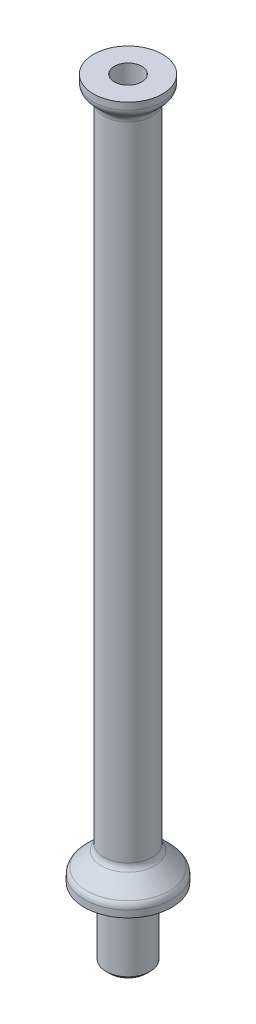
SolidWorks part; units mm, degrees
ref_plane "Front" through (0, 0, 0) normal (0, 0, 1) x (1, 0, 0)
ref_plane "Top" through (0, 0, 0) normal (0, 1, 0) x (1, 0, 0)
ref_plane "Right" through (0, 0, 0) normal (1, 0, 0) x (0, 0, -1)
sketch "Sketch1" plane through (0, 0, 0) normal (0, 0, 1) x (1, 0, 0)
  line L0 (-7.9375, -25.4) -> (-7.9375, -1.905)
  line L1 (0, -25.4) -> (0, 254)
  line L2 (0, 254) -> (-12.5, 254)
  line L3 (-12.5, 254) -> (-12.5, 250.19)
  line L4 (-12.5, 250.19) -> (-8.7709, 246.4609)
  line L5 (-8.7709, 246.4609) -> (-8.7709, 10.9141)
  line L6 (-6.9037, 0) -> (-15.875, 0)
  line L7 (-7.9375, -25.4) -> (0, -25.4)
  line L8 (0, 0) -> (0, 113.8685) construction
  line L9 (-8.7709, 10.9141) -> (-15.875, 3.81)
  line L10 (-15.875, 3.81) -> (-15.875, 0)
  line L11 (-7.9375, -1.905) -> (-6.9037, -1.905)
  line L12 (-6.9037, -1.905) -> (-6.9037, 0)
  dimension "D1" = 17.5419
  dimension "D2" = 25.4
  dimension "D3" = 15.875
  dimension "D4" = 3.81
  dimension "D5" = 254
  dimension "D6" = 25
  dimension "D7" = 3.81
  dimension "D8" = 135
  dimension "D9" = 135
  dimension "D10" = 31.75
  dimension "D11" = 1.905
  dimension "D12" = 1.0338
revolve "Revolve1" add sketch "Sketch1" angle 360 about L8
hole_wizard "7/16-20 Tapped Hole1" positions "Sketch3" profile "Sketch2" tap size "7/16-20" standard "ANSI Inch"
sketch "Sketch3" plane through (0, 254, 0) normal (0, 1, 0) x (1, 0, 0)
  point P0 (0, 0)
sketch "Sketch2" plane through (0, 254, 0) normal (1, 0, 0) x (0, 0, 1)
  line L0 (0, 0) -> (0, 279.4)
  line L1 (0, 279.4) -> (4.9606, 279.4)
  line L2 (4.9606, 279.4) -> (4.9606, 0)
  line L5 (4.9606, 0) -> (0, 0)
  line L11 (0, -6.35) -> (0, 107.95) construction
  dimension "Thru Tap Drill Dia." = 9.9212
  dimension "Thru Tap Drill Depth" = 279.4
sketch "Sketch11" plane through (-8.4074, 0, -14.3614) normal (0, -1, 0) x (1, 0, 0)
  line L0 (8.4074, 30.2364) -> (8.4074, 14.3614) construction
  circle A0 centre (8.4074, 14.3614) radius 15.875 construction
ref_plane "Plane3" through (0, 0, 0) normal (0, 0, -1) x (1, 0, 0)
sketch "Groove Sketch" plane through (0, 0, 0) normal (0, 0, 1) x (0, -1, 0)
  line L0 (-2.1971, -8.5217) -> (0, -8.5217)
  line L1 (0, -8.5217) -> (0, -13.1445)
  line L2 (0, -13.1445) -> (-2.1971, -13.1445)
  line L3 (-2.6416, -12.7) -> (-2.6416, -8.9662)
  line L4 (0, 0) -> (-1.5769, 0) construction
  line L6 (0, -15.875) -> (0, 15.875) construction
  arc A0 (-2.1971, -13.1445) -> (-2.6416, -12.7) centre (-2.1971, -12.7) cw
  arc A1 (-2.6416, -8.9662) -> (-2.1971, -8.5217) centre (-2.1971, -8.9662) cw
  dimension "D1" = 4.6228
  dimension "Radius" = 0.4445
  dimension "ID" = 17.0434
  dimension "Depth" = 2.6416
revolve "O-Ring Groove" cut sketch "Groove Sketch" angle 360 about L4
other "face static - liquid (as 568)<1>"
fillet "Fillet2" radius 0.127 2 edges at (-8.5217, 0, 0) (-13.1445, 0, 0)
fillet "Fillet3" radius 3.175 4 edges at (0, 10.9141, -8.7709) (0, 250.19, -12.5) (0, 3.81, -15.875) (0, 246.4609, -8.7709)
chamfer "Chamfer1" distance 1.27 angle 45 1 edges at (0, -25.4, -7.9375)
